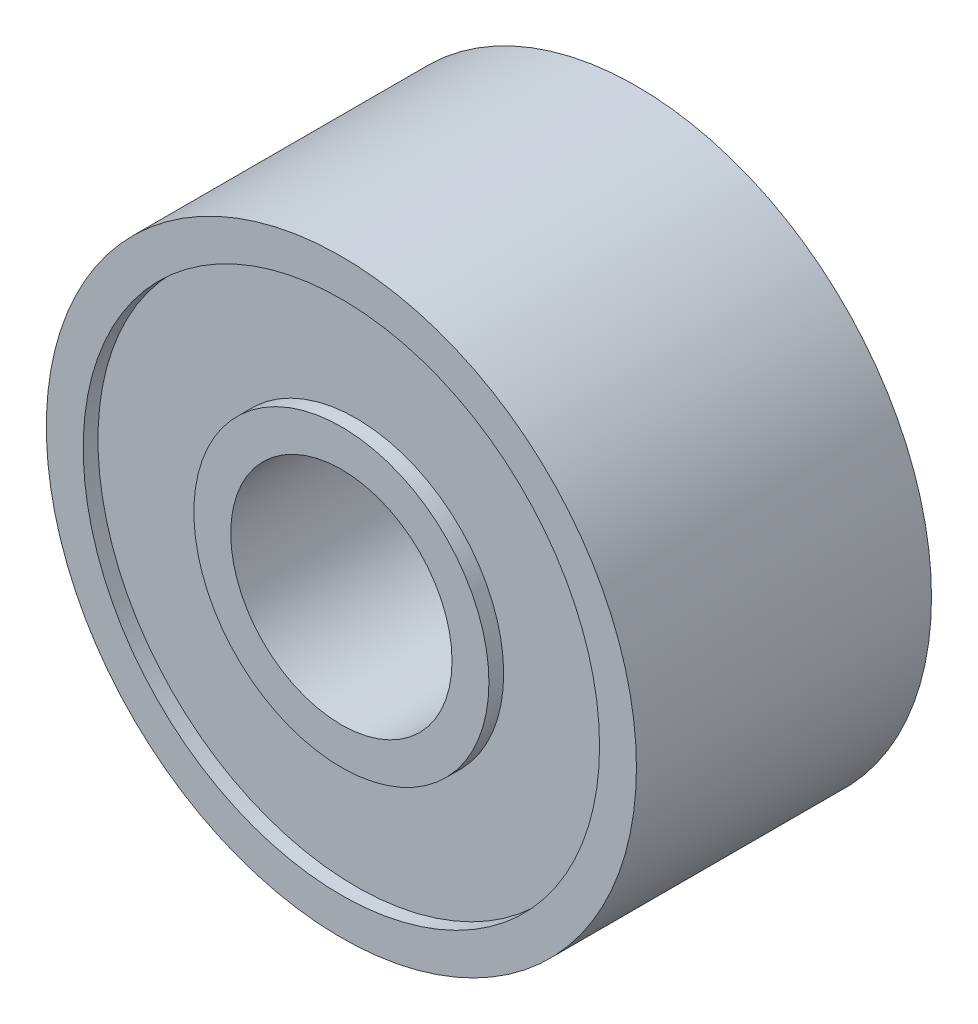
SolidWorks part; units mm, degrees
ref_plane "Спереди" through (0, 0, 0) normal (0, 0, 1) x (1, 0, 0)
ref_plane "Сверху" through (0, 0, 0) normal (0, 1, 0) x (1, 0, 0)
ref_plane "Справа" through (0, 0, 0) normal (1, 0, 0) x (0, 0, -1)
other "Configuration Table"
sketch "Эскиз1" plane through (0, 0, 0) normal (0, 0, 1) x (1, 0, 0)
  circle A0 centre (0, 0) radius 4
  circle A1 centre (0, 0) radius 1.5
  dimension "D1" = 8
  dimension "D2" = 3
extrude "Бобышка-Вытянуть1" add sketch "Эскиз1" along normal blind 4
sketch "Эскиз2" plane through (0, 0, 4) normal (0, 0, 1) x (1, 0, 0)
  circle A2 centre (0, 0) radius 3.5
  circle A3 centre (0, 0) radius 3.5
  circle A5 centre (0, 0) radius 2
  circle A6 centre (0, 0) radius 2
  dimension "D1" = 0.5
  dimension "D2" = 0.5
extrude "Вырез-Вытянуть1" cut sketch "Эскиз2" against normal blind 0.2
sketch "Эскиз3" plane through (0, 0, 0) normal (0, 0, -1) x (-1, 0, 0)
  circle A0 centre (0, 0) radius 2 construction
  circle A1 centre (0, 0) radius 3.5
  circle A2 centre (0, 0) radius 3.5
  circle A3 centre (0, 0) radius 2
  dimension "D1" = 0
extrude "Вырез-Вытянуть2" cut sketch "Эскиз3" against normal blind 0.2
